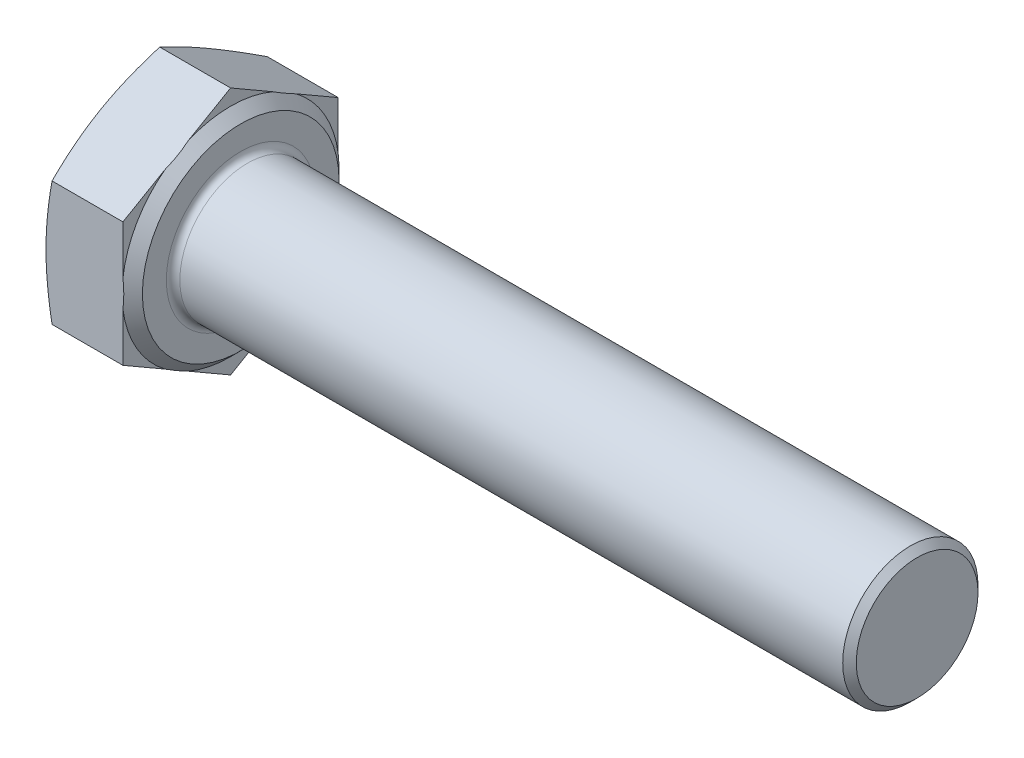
SolidWorks part; units mm, degrees
ref_plane "Front" through (0, 0, 0) normal (0, 0, 1) x (1, 0, 0)
ref_plane "Top" through (0, 0, 0) normal (0, 1, 0) x (1, 0, 0)
ref_plane "Right" through (0, 0, 0) normal (1, 0, 0) x (0, 0, -1)
sketch "Sketch2" plane through (0, 0, 0) normal (1, 0, 0) x (0, 0, -1)
  line L1 (0, -7.3497) -> (6.365, -3.6748)
  line L2 (6.365, -3.6748) -> (6.365, 3.6748)
  line L3 (6.365, 3.6748) -> (0, 7.3497)
  line L4 (0, 7.3497) -> (-6.365, 3.6748)
  line L5 (-6.365, 3.6748) -> (-6.365, -3.6748)
  line L6 (-6.365, -3.6748) -> (0, -7.3497)
  circle A0 centre (0, 0) radius 6.365 construction
  dimension "s" = 12.73
extrude "BaseHead" add sketch "Sketch2" along normal blind 5.15
sketch "Sketch3" plane through (0, 0, 0) normal (0, 0, 1) x (1, 0, 0)
  line L0 (5.15, 7.3497) -> (5.15, 5.815)
  line L2 (5.15, 5.815) -> (4.55, 6.415)
  line L3 (4.55, 6.415) -> (4.55, 7.3497)
  line L5 (4.55, 7.3497) -> (5.15, 7.3497)
  line L6 (-0.9571, 0) -> (7.6478, 0) construction
  line L7 (5.15, 7.3497) -> (0, 7.3497) construction
  dimension "D1" = 45
  dimension "c" = 0.6
  dimension "dw" = 11.63
revolve "BearingFace" cut sketch "Sketch3" angle 360 about L6
sketch "Sketch4" plane through (0, 0, 0) normal (0, 0, 1) x (1, 0, 0)
  line L0 (-0.4935, 0) -> (3.5626, 0) construction
  line L2 (0, 7.3497) -> (0.3584, 7.3497)
  line L4 (0.3584, 7.3497) -> (0, 6.365)
  line L6 (0, 6.365) -> (0, 7.3497)
  line L7 (4.55, 7.3497) -> (0, 7.3497) construction
  dimension "D1" = 20
  dimension "D2" = 12.73
revolve "HeadChamfer" cut sketch "Sketch4" angle 360 about L0
ref_plane "Plane1" through (23.15, 0, 0) normal (1, 0, 0) x (0, 0, -1)
sketch "Sketch5" plane through (5.15, 0, 0) normal (1, 0, 0) x (0, 0, -1)
  circle A0 centre (0, 0) radius 4
  dimension "d" = 8
extrude "BaseBody" add sketch "Sketch5" along normal blind 40
chamfer "Chamfer1" distance 0.4 angle 45 1 edges at (45.15, 0, -4)
fillet "HeadFillet" radius 0.4 1 edges at (5.15, 0, 4)
equation "\"D2@Sketch4\" = \"s@Sketch2\""
equation "\"b@ThreadCosmetic1\" = \"l@BaseBody\" - \"lg@Plane1\""
equation "\"D1@Chamfer1\" = 0.05 * \"d@Sketch5\""
